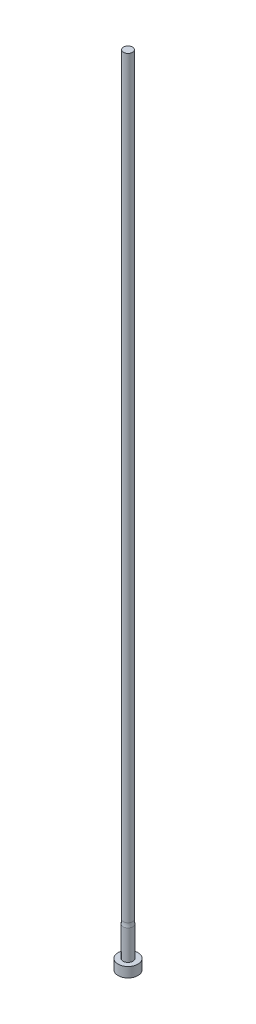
SolidWorks part; units mm, degrees
ref_plane "Front Plane" through (0, 0, 0) normal (0, 0, 1) x (1, 0, 0)
ref_plane "Top Plane" through (0, 0, 0) normal (0, 1, 0) x (1, 0, 0)
ref_plane "Right Plane" through (0, 0, 0) normal (1, 0, 0) x (0, 0, -1)
sketch "Sketch2" plane through (0, 0, 0) normal (0, 0, 1) x (1, 0, 0)
  line L0 (0, 0) -> (3.175, 0)
  line L1 (55, 0) -> (-55, 0) construction
  line L2 (3.175, 0) -> (3.175, 3.175)
  line L3 (3.175, 3.175) -> (1.5875, 3.175)
  line L4 (1.5875, 3.175) -> (1.5875, 12.7)
  line L5 (1.5875, 12.7) -> (1.4516, 12.7)
  line L6 (1.4516, 12.7) -> (1.4516, 254)
  line L7 (1.4516, 254) -> (0, 254)
  line L8 (0, 254) -> (0, 0)
  dimension "D1" = 3.175
  dimension "D2" = 3.175
  dimension "D3" = 1.5875
  dimension "D4" = 12.7
  dimension "D5" = 1.4516
  dimension "D6" = 254
revolve "Revolve1" add sketch "Sketch2" angle 360 about L8
fillet "Fillet1" radius 6.35 1 edges at (-1.4516, 12.7, 0)
